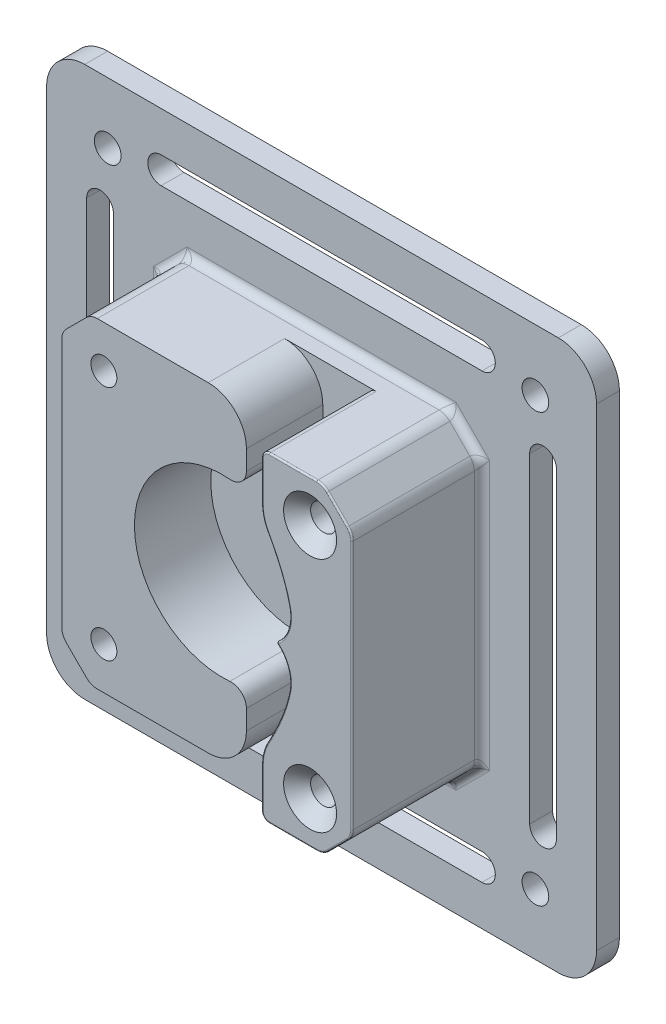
SolidWorks part; units mm, degrees
ref_plane "Front Plane" through (0, 0, 0) normal (0, 0, 1) x (1, 0, 0)
ref_plane "Top Plane" through (0, 0, 0) normal (0, 1, 0) x (1, 0, 0)
ref_plane "Right Plane" through (0, 0, 0) normal (1, 0, 0) x (0, 0, -1)
ref_plane "Plane1" through (0, 0, 62.2) normal (0, 0, 1) x (1, 0, 0)
sketch "Sketch19" plane through (0, 0, 62.2) normal (0, 0, 1) x (1, 0, 0)
  line L0 (-1.2333, 91.3812) -> (-1.2333, 83.6172)
  line L1 (-1.2333, 83.6172) -> (6.8045, 83.6172)
  line L2 (6.8045, 83.6172) -> (10.6045, 87.4172)
  line L3 (10.6045, 87.4172) -> (10.6045, 121.8172)
  line L4 (10.6045, 121.8172) -> (6.8045, 125.6172)
  line L5 (6.8045, 125.6172) -> (-1.2333, 125.6172)
  line L6 (-1.2333, 125.6172) -> (-1.2333, 117.8531)
  arc A0 (2.411, 109.185) -> (0.6753, 104.6172) centre (-2.3471, 108.3793) cw
  arc A1 (0.6753, 104.6172) -> (2.411, 100.0493) centre (-2.3471, 100.855) cw
  spline S0 degree 3 poles (-1.2333, 91.3812) (-0.9775, 91.8076) (-0.7294, 92.2387) (-0.4896, 92.6743) (0.7842, 94.9885) (1.9034, 97.4569) (2.411, 100.0493) knots -0.001483 -0.001483 -0.001483 -0.001483 0 0 0 0.007925 0.007925 0.007925 0.007925
  spline S1 degree 3 poles (-1.2333, 117.8531) (-0.9775, 117.4267) (-0.7294, 116.9956) (-0.4896, 116.56) (0.7842, 114.2458) (1.9034, 111.7774) (2.411, 109.185) knots -0.001483 -0.001483 -0.001483 -0.001483 0 0 0 0.007925 0.007925 0.007925 0.007925
extrude "Boss-Extrude6" add sketch "Sketch19" against normal blind 14
ref_plane "Plane2" through (0, 0, 48.2) normal (0, 0, -1) x (-1, 0, 0)
sketch "Sketch24" plane through (0, 0, 48.2) normal (0, 0, -1) x (-1, 0, 0)
  line L0 (27.5955, 125.6172) -> (31.3955, 121.8172)
  line L1 (31.3955, 121.8172) -> (31.3955, 87.4172)
  line L2 (31.3955, 87.4172) -> (27.5955, 83.6172)
  line L3 (27.5955, 83.6172) -> (-6.8045, 83.6172)
  line L4 (-6.8045, 83.6172) -> (-10.6045, 87.4172)
  line L5 (-10.6045, 87.4172) -> (-10.6045, 121.8172)
  line L6 (-10.6045, 121.8172) -> (-6.8045, 125.6172)
  line L7 (-6.8045, 125.6172) -> (27.5955, 125.6172)
extrude "Boss-Extrude7" add sketch "Sketch24" along normal blind 3
sketch "Sketch25" plane through (0, 0, 45.2) normal (0, 0, -1) x (-1, 0, 0)
  line L0 (31.3955, 125.6172) -> (31.3955, 68.6172)
  line L1 (31.3955, 68.6172) -> (-25.6045, 68.6172)
  line L2 (-25.6045, 68.6172) -> (-25.6045, 125.6172)
  line L3 (-25.6045, 125.6172) -> (31.3955, 125.6172)
extrude "Boss-Extrude8" add sketch "Sketch25" along normal blind 3
sketch "Sketch26" plane through (0, 125.6172, 0) normal (0, 1, 0) x (-1, 0, 0)
  line L0 (31.3955, 42.2) -> (-25.6045, 42.2)
  line L1 (-25.6045, 42.2) -> (-25.6045, 45.2)
  line L2 (-25.6045, 45.2) -> (31.3955, 45.2)
  line L3 (31.3955, 45.2) -> (31.3955, 42.2)
extrude "Boss-Extrude9" add sketch "Sketch26" along normal blind 15
sketch "Sketch27" plane through (-31.3955, 0, 0) normal (-1, 0, 0) x (0, 0, 1)
  line L0 (45.2, 140.6172) -> (45.2, 68.6172)
  line L1 (45.2, 68.6172) -> (42.2, 68.6172)
  line L2 (42.2, 68.6172) -> (42.2, 140.6172)
  line L3 (42.2, 140.6172) -> (45.2, 140.6172)
extrude "Boss-Extrude10" add sketch "Sketch27" along normal blind 15
sketch "Sketch28" plane through (0, 0, 48.2) normal (0, 0, 1) x (1, 0, 0)
  line L0 (-27.5955, 125.6172) -> (-7.2333, 125.6172)
  line L1 (-7.2333, 125.6172) -> (-7.2333, 83.6172)
  line L2 (-7.2333, 83.6172) -> (-27.5955, 83.6172)
  line L3 (-27.5955, 83.6172) -> (-31.3955, 87.4172)
  line L4 (-31.3955, 87.4172) -> (-31.3955, 121.8172)
  line L5 (-31.3955, 121.8172) -> (-27.5955, 125.6172)
extrude "Boss-Extrude11" add sketch "Sketch28" along normal blind 10
sketch "Sketch29" plane through (0, 0, 58.2) normal (0, 0, 1) x (1, 0, 0)
  line L0 (-7.2333, 93.5605) -> (-7.2333, 115.6738)
  arc A0 (-7.2333, 115.6738) -> (-7.2333, 93.5605) centre (-10.3955, 104.6172) ccw
extrude "Cut-Extrude6" cut sketch "Sketch29" against normal blind 10
sketch "Sketch30" plane through (0, 0, 45.2) normal (0, 0, 1) x (1, 0, 0)
  line L0 (10.6045, 135.3672) -> (-31.3955, 135.3672)
  line L1 (-31.3955, 131.8672) -> (10.6045, 131.8672)
  arc A0 (-31.3955, 135.3672) -> (-31.3955, 131.8672) centre (-31.3955, 133.6172) ccw
  arc A1 (10.6045, 131.8672) -> (10.6045, 135.3672) centre (10.6045, 133.6172) ccw
extrude "Cut-Extrude7" cut sketch "Sketch30" against normal through all
sketch "Sketch31" plane through (0, 0, 45.2) normal (0, 0, 1) x (1, 0, 0)
  line L0 (-41.1455, 125.6172) -> (-41.1455, 83.6172)
  line L1 (-37.6455, 83.6172) -> (-37.6455, 125.6172)
  arc A0 (-41.1455, 83.6172) -> (-37.6455, 83.6172) centre (-39.3955, 83.6172) ccw
  arc A1 (-37.6455, 125.6172) -> (-41.1455, 125.6172) centre (-39.3955, 125.6172) ccw
extrude "Cut-Extrude8" cut sketch "Sketch31" against normal through all
sketch "Sketch32" plane through (0, 0, 45.2) normal (0, 0, 1) x (1, 0, 0)
  line L0 (-31.3955, 73.8672) -> (10.6045, 73.8672)
  line L1 (10.6045, 77.3672) -> (-31.3955, 77.3672)
  arc A0 (10.6045, 73.8672) -> (10.6045, 77.3672) centre (10.6045, 75.6172) ccw
  arc A1 (-31.3955, 77.3672) -> (-31.3955, 73.8672) centre (-31.3955, 75.6172) ccw
extrude "Cut-Extrude9" cut sketch "Sketch32" against normal through all
sketch "Sketch33" plane through (0, 0, 42.2) normal (0, 0, -1) x (-1, 0, 0)
  line L0 (-20.3545, 125.6172) -> (-20.3545, 83.6172)
  line L1 (-16.8545, 83.6172) -> (-16.8545, 125.6172)
  arc A0 (-16.8545, 125.6172) -> (-20.3545, 125.6172) centre (-18.6045, 125.6172) ccw
  arc A1 (-20.3545, 83.6172) -> (-16.8545, 83.6172) centre (-18.6045, 83.6172) ccw
extrude "Cut-Extrude10" cut sketch "Sketch33" against normal through all
hole_wizard "Ø3.5 (3.5) Diameter Hole2" positions "Sketch35" profile "Sketch34" hole size "Ø3.5" standard "ANSI Metric"
sketch "Sketch35" plane through (0, 0, 42.2) normal (0, 0, -1) x (-1, 0, 0)
  point P0 (-17.6045, 132.6172)
  point P1 (38.3955, 132.6172)
  point P2 (38.3955, 76.6172)
  point P3 (-17.6045, 76.6172)
sketch "Sketch34" plane through (17.6045, 132.6172, 42.2) normal (1, 0, 0) x (0, 1, 0)
  line L0 (0, 0) -> (0, 20)
  line L1 (0, 20) -> (1.75, 20)
  line L2 (1.75, 20) -> (1.75, 0)
  line L5 (1.75, 0) -> (0, 0)
  line L11 (0, -6.35) -> (0, 107.95) construction
  dimension "Thru Hole Dia." = 3.5
  dimension "Thru Hole Depth" = 20
hole_wizard "Ø3.4 (3.4) Diameter Hole3" positions "Sketch37" profile "Sketch36" hole size "Ø3.4" standard "ANSI Metric"
sketch "Sketch37" plane through (0, 0, 42.2) normal (0, 0, -1) x (-1, 0, 0)
  point P0 (25.8955, 89.1172)
  point P1 (25.8955, 120.1172)
sketch "Sketch36" plane through (-25.8955, 89.1172, 42.2) normal (1, 0, 0) x (0, 1, 0)
  line L0 (0, 0) -> (0, 20)
  line L1 (0, 20) -> (1.7, 20)
  line L2 (1.7, 20) -> (1.7, 0)
  line L5 (1.7, 0) -> (0, 0)
  line L11 (0, -6.35) -> (0, 107.95) construction
  dimension "Thru Hole Dia." = 3.4
  dimension "Thru Hole Depth" = 20
hole_wizard "Ø3.4 (3.4) Diameter Hole4" positions "Sketch39" profile "Sketch38" hole size "Ø3.4" standard "ANSI Metric"
sketch "Sketch39" plane through (0, 0, 42.2) normal (0, 0, -1) x (-1, 0, 0)
  point P0 (-5.1045, 89.1172)
  point P1 (-5.1045, 120.1172)
sketch "Sketch38" plane through (5.1045, 89.1172, 42.2) normal (1, 0, 0) x (0, 1, 0)
  line L0 (0, 0) -> (0, 20)
  line L1 (0, 20) -> (1.7, 20)
  line L2 (1.7, 20) -> (1.7, 0)
  line L5 (1.7, 0) -> (0, 0)
  line L11 (0, -6.35) -> (0, 107.95) construction
  dimension "Thru Hole Dia." = 3.4
  dimension "Thru Hole Depth" = 20
hole_wizard "Hole2" positions "Sketch41" profile "Sketch40" legacy
sketch "Sketch41" plane through (0, 0, 42.2) normal (0, 0, -1) x (-1, 0, 0)
  point P0 (10.3955, 104.6172)
sketch "Sketch40" plane through (-10.3955, 104.6172, 42.2) normal (1, 0, 0) x (0, 1, 0)
  line L0 (0, 0) -> (0, 20)
  line L1 (0, 20) -> (2.6, 20)
  line L2 (2.6, 20) -> (2.6, 2)
  line L3 (2.6, 2) -> (11.5, 2)
  line L4 (11.5, 2) -> (11.5, 0)
  line L5 (11.5, 0) -> (0, 0)
  line L6 (0, 110) -> (0, -10) construction
  dimension "Diameter" = 5.2
  dimension "Depth" = 20
  dimension "C-Bore Diameter" = 23
  dimension "C-Bore Depth" = 2
fillet "Fillet6" radius 1 10 edges at (-10.3955, 83.6172, 45.2) (8.7045, 85.5172, 45.2) (10.6045, 104.6172, 45.2)
fillet "Fillet7" radius 2 10 edges at (-7.2333, 93.5605, 53.2) (-7.2333, 115.6738, 53.2) (-27.5955, 83.6172, 52.2) (10.6045, 87.4172, 54.2) (6.8045, 83.6172, 54.2) (10.6045, 121.8172, 54.2)
fillet "Fillet8" radius 6 2 edges at (-1.2333, 91.3812, 55.2) (-1.2333, 117.8531, 55.2)
fillet "Fillet9" radius 0.2 20 edges at (0.6753, 104.6172, 55.2) (2.164, 106.6652, 62.2) (-1.0444, 117.9597, 62.2) (-1.2333, 122.0353, 62.2) (-0.9404, 125.3243, 62.2) (2.8714, 125.6172, 62.2) (6.7414, 125.4649, 62.2) (8.7045, 123.7172, 62.2) (10.4523, 121.7541, 62.2) (10.6045, 104.6172, 62.2) (10.4523, 87.4802, 62.2) (8.7045, 85.5172, 62.2) (2.164, 102.5691, 62.2) (6.7414, 83.7694, 62.2) (2.8714, 83.6172, 62.2) (-1.0444, 91.2746, 62.2) (-0.9404, 83.91, 62.2) (-1.2333, 87.199, 62.2)
fillet "Fillet10" radius 5 6 edges at (-46.3955, 68.6172, 43.7) (-7.2333, 83.6172, 53.2) (25.6045, 68.6172, 43.7) (-46.3955, 140.6172, 43.7) (-7.2333, 125.6172, 53.2) (25.6045, 140.6172, 43.7)
chamfer "Chamfer1" distance 1.77 angle 45 2 edges at (6.8045, 89.1172, 62.2) (6.8045, 120.1172, 62.2)
